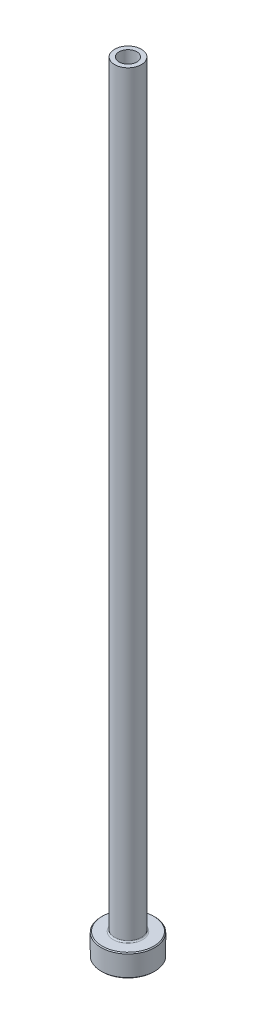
SolidWorks part; units mm, degrees
ref_plane "Front Plane" through (0, 0, 0) normal (0, 0, 1) x (1, 0, 0)
ref_plane "Top Plane" through (0, 0, 0) normal (0, 1, 0) x (1, 0, 0)
ref_plane "Right Plane" through (0, 0, 0) normal (1, 0, 0) x (0, 0, -1)
sketch "Sketch1" plane through (0, 0, 0) normal (0, 0, 1) x (1, 0, 0)
  line L0 (-2, 175) -> (-3, 175)
  line L1 (-3, 175) -> (-3, 5)
  line L2 (-3, 5) -> (-6, 5)
  line L3 (-6, 5) -> (-6, 0)
  line L4 (6.6, 0) -> (-6.6, 0) construction
  line L5 (-6, 0) -> (-2.25, 0)
  line L6 (-2, 130) -> (-2, 175)
  line L7 (0, 92.1877) -> (0, -15.5353) construction
  line L8 (0, -6.6) -> (0, 6.6) construction
  line L9 (-2, 130) -> (-2.25, 118)
  line L10 (-2.25, 118) -> (-2.25, 0)
  dimension "D1" = 0.25
  dimension "ID" = 4
  dimension "OD" = 6
  dimension "L" = 175
  dimension "H" = 12
  dimension "T" = 5
  dimension "N" = 45
  dimension "D2" = 12
revolve "Revolve1" add sketch "Sketch1" angle 360 about L7
fillet "Fillet1" radius 0.3 1 edges at (0, 5, 3)
chamfer "Chamfer1" distance 0.2 angle 45 2 edges at (0, 5, 6) (0, 0, 6)
chamfer "Chamfer3" distance 0.5 angle 45 1 edges at (0, 0, 2.25)
